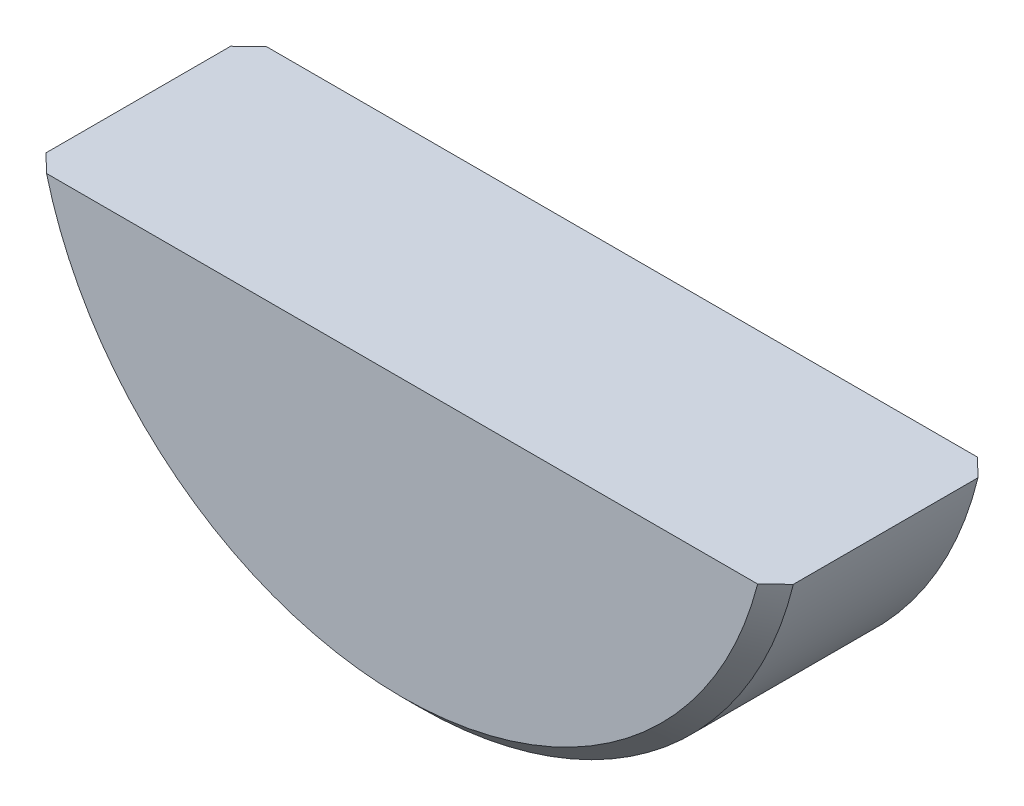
SolidWorks part; units mm, degrees
ref_plane "Front" through (0, 0, 0) normal (0, 0, 1) x (1, 0, 0)
ref_plane "Top" through (0, 0, 0) normal (0, 1, 0) x (1, 0, 0)
ref_plane "Right" through (0, 0, 0) normal (1, 0, 0) x (0, 0, -1)
other "Configuration Table"
sketch "Sketch1" plane through (0, 0, 0) normal (0, 0, 1) x (1, 0, 0)
  line L0 (-3.4, -0.8307) -> (3.4, -0.8307)
  arc A0 (-3.4, -0.8307) -> (3.4, -0.8307) centre (0, 0) ccw
  dimension "d1" = 7
  dimension "h" = 2.6693
extrude "BaseKey" add sketch "Sketch1" along normal mid plane 2
chamfer "Chamfer1" distance 0.16 angle 45 2 edges at (0, -3.5, 1) (0, -3.5, -1)
